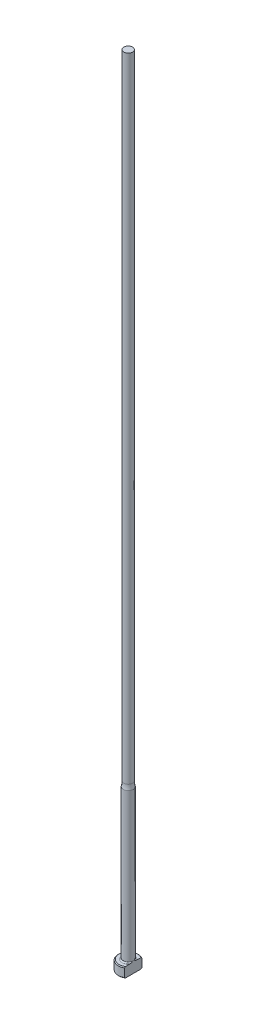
SolidWorks part; units mm, degrees
ref_plane "Front Plane" through (0, 0, 0) normal (0, 0, 1) x (1, 0, 0)
ref_plane "Top Plane" through (0, 0, 0) normal (0, 1, 0) x (1, 0, 0)
ref_plane "Right Plane" through (0, 0, 0) normal (1, 0, 0) x (0, 0, -1)
sketch "Sketch1" plane through (0, 0, 0) normal (0, 0, 1) x (1, 0, 0)
  line L0 (0, 259.9588) -> (0, -15.1925) construction
  line L1 (0, 0) -> (-3.175, 0)
  line L2 (-3.175, 0) -> (-3.175, 3.175)
  line L3 (-3.175, 3.175) -> (-1.5875, 3.175)
  line L4 (-1.3881, 52.3788) -> (-1.3881, 254)
  line L5 (-1.3881, 254) -> (0, 254)
  line L6 (0, 254) -> (0, 0)
  line L7 (-1.5875, 3.175) -> (-1.5875, 50.8)
  arc A0 (-1.5875, 50.8) -> (-1.3881, 52.3788) centre (-7.7381, 52.3788) ccw
  point P13 (-1.5875, 0)
  dimension "D1" = 6.35
  dimension "L" = 254
  dimension "D2" = 3.175
  dimension "H" = 6.35
  dimension "T" = 3.175
  dimension "D" = 2.7762
  dimension "S" = 50.8
revolve "Revolve1" add sketch "Sketch1" angle 360 about L0
chamfer "Chamfer1" distance 0.254 angle 45 2 edges at (0, 3.175, 3.175) (0, 0, 3.175)
fillet "Fillet1" radius 0.381 1 edges at (0, 3.175, 1.5875)
sketch "Sketch2" plane through (0, 0, 0) normal (0, 1, 0) x (1, 0, 0)
  line L0 (1.5875, -2.7496) -> (1.5875, 2.7496)
  circle A0 centre (0, 0) radius 3.175 construction
  arc A2 (1.5875, -2.7496) -> (1.5875, 2.7496) centre (0, 0) ccw
  circle A3 centre (0, 0) radius 3.175 construction
  circle A4 centre (0, 0) radius 1.5875 construction
extrude "Key Head" cut sketch "Sketch2" along normal up to next
